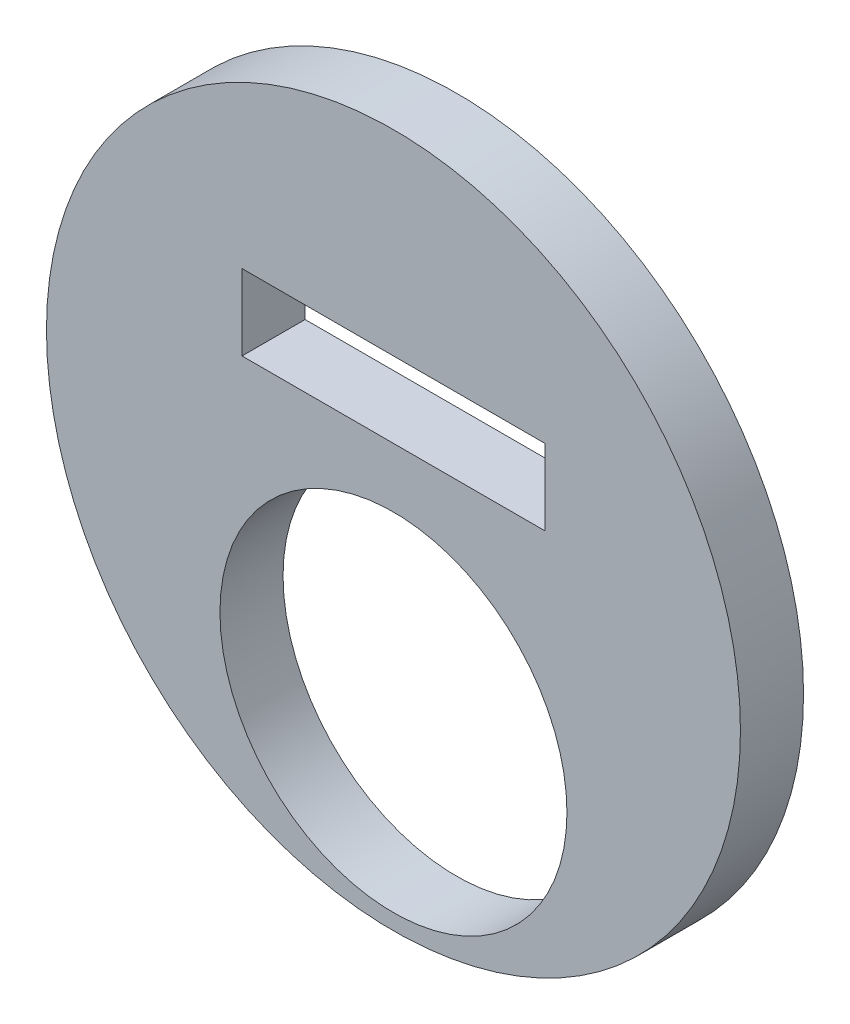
SolidWorks part; units mm, degrees
ref_plane "Front Plane" through (0, 0, 0) normal (0, 0, 1) x (1, 0, 0)
ref_plane "Top Plane" through (0, 0, 0) normal (0, 1, 0) x (1, 0, 0)
ref_plane "Right Plane" through (0, 0, 0) normal (1, 0, 0) x (0, 0, -1)
sketch "Sketch1" plane through (0, 0, 0) normal (0, 0, 1) x (1, 0, 0)
  line L1 (-14.5241, 7.5946) -> (13.9403, 7.5946) construction
  line L2 (0, 17.4625) -> (11.7794, 17.4625) construction
  line L3 (-7.62, 7.5946) -> (7.62, 7.5946)
  line L4 (-7.62, 7.5946) -> (-7.62, 3.7846)
  line L5 (-7.62, 3.7846) -> (7.62, 3.7846)
  line L6 (7.62, 7.5946) -> (7.62, 3.7846)
  circle A0 centre (0, 0) radius 17.4625
  dimension "D1" = 15.24
  dimension "D2" = 34.925
  dimension "D3" = 7.62
  dimension "D4" = 3.81
  dimension "D5" = 9.8679
extrude "Extrude1" add sketch "Sketch1" along normal blind 3.175
sketch "Sketch2" plane through (0, 0, 3.175) normal (0, 0, 1) x (1, 0, 0)
  line L0 (0, 17.4625) -> (19.8053, 17.4625) construction
  line L1 (0, -17.4625) -> (24.5189, -17.4625) construction
  circle A0 centre (0, -7.9375) radius 8.7313
  circle A1 centre (0, 0) radius 17.4625 construction
  dimension "D1" = 17.4625
  dimension "D2" = 9.525
extrude "Cut-Extrude1" cut sketch "Sketch2" against normal blind 3.175
